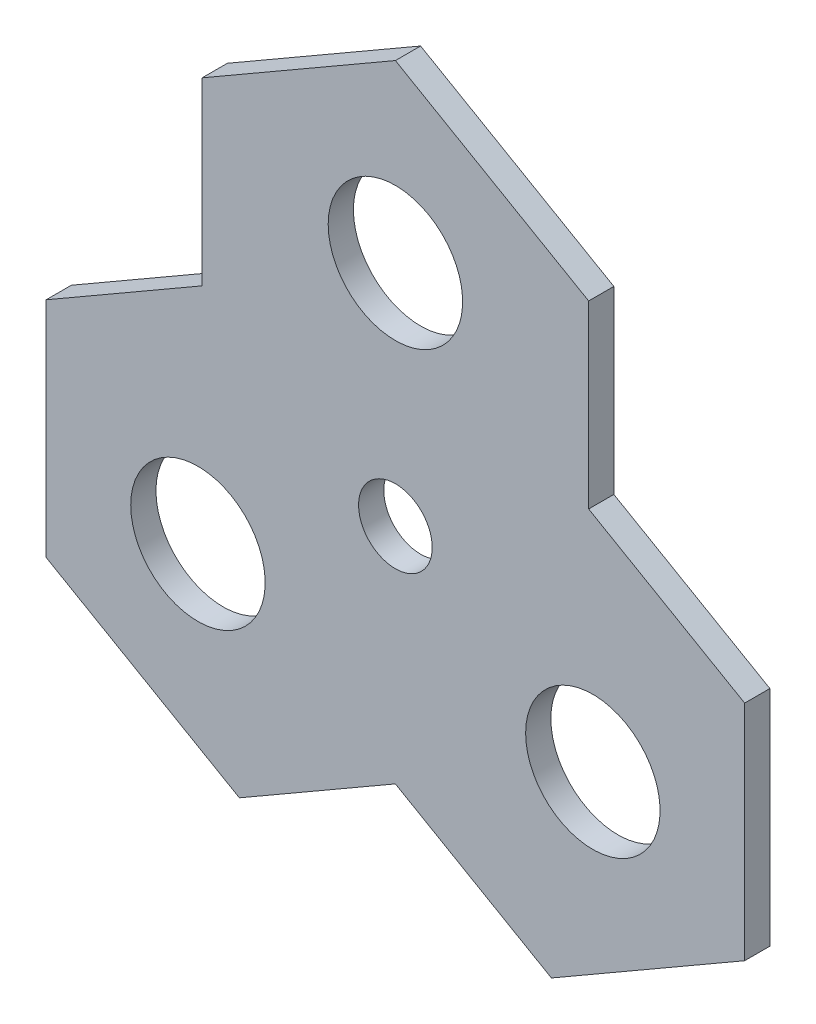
SolidWorks part; units mm, degrees
ref_plane "Front Plane" through (0, 0, 0) normal (0, 0, 1) x (1, 0, 0)
ref_plane "Top Plane" through (0, 0, 0) normal (0, 1, 0) x (1, 0, 0)
ref_plane "Right Plane" through (0, 0, 0) normal (1, 0, 0) x (0, 0, -1)
sketch "Sketch2" plane through (0, 0, 0) normal (0, 0, 1) x (1, 0, 0)
  line L28 (0, 152.4) -> (73.025, 110.239)
  line L29 (73.025, 110.239) -> (73.025, 42.161)
  line L30 (0, 152.4) -> (-73.025, 110.239)
  line L31 (-73.025, 110.239) -> (-73.025, 42.161)
  line L32 (131.9823, 8.122) -> (73.025, 42.161)
  line L33 (131.9823, -76.2) -> (131.9823, 8.122)
  line L34 (131.9823, -76.2) -> (58.9573, -118.361)
  line L35 (58.9573, -118.361) -> (0, -84.322)
  line L36 (-58.9573, -118.361) -> (0, -84.322)
  line L37 (-131.9823, -76.2) -> (-58.9573, -118.361)
  line L38 (-131.9823, -76.2) -> (-131.9823, 8.122)
  line L39 (-131.9823, 8.122) -> (-73.025, 42.161)
  line L40 (0, 152.4) -> (-86.9976, 152.4) construction
  circle A0 centre (0, 0) radius 13.9189
  circle A3 centre (0, 86.1551) radius 25.4
  circle A4 centre (74.6125, -43.0775) radius 25.4
  circle A5 centre (-74.6125, -43.0775) radius 25.4
  point P23 (0, 0)
  point P29 (0, 0)
  point P30 (0, 0)
  dimension "D1" = 152.4
  dimension "D3" = 50.8
  dimension "D5" = 30
  dimension "D2" = 146.05
  dimension "D4" = 3
extrude "Boss-Extrude1" add sketch "Sketch2" along normal blind 9.525
